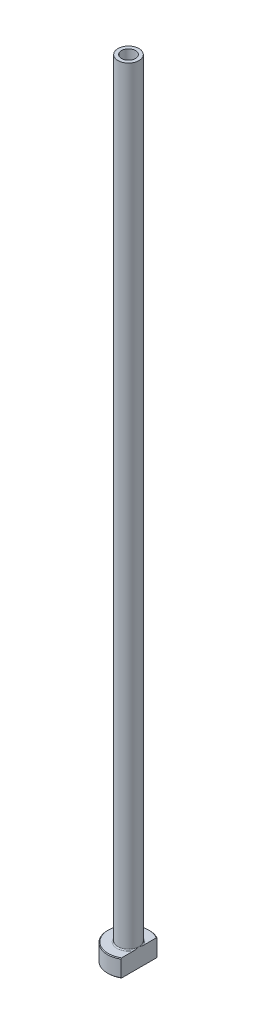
SolidWorks part; units mm, degrees
ref_plane "Front Plane" through (0, 0, 0) normal (0, 0, 1) x (1, 0, 0)
ref_plane "Top Plane" through (0, 0, 0) normal (0, 1, 0) x (1, 0, 0)
ref_plane "Right Plane" through (0, 0, 0) normal (1, 0, 0) x (0, 0, -1)
sketch "Sketch1" plane through (0, 0, 0) normal (0, 0, 1) x (1, 0, 0)
  line L0 (-2, 225) -> (-3, 225)
  line L1 (-3, 225) -> (-3, 5)
  line L2 (-3, 5) -> (-6, 5)
  line L3 (-6, 5) -> (-6, 0)
  line L4 (4.95, 0) -> (-4.95, 0) construction
  line L5 (-6, 0) -> (-2.25, 0)
  line L6 (-2, 180) -> (-2, 225)
  line L7 (0, 92.1877) -> (0, -15.5353) construction
  line L8 (0, -6.6) -> (0, 6.6) construction
  line L9 (-2, 180) -> (-2.25, 168)
  line L10 (-2.25, 168) -> (-2.25, 0)
  dimension "D1" = 0.25
  dimension "ID" = 4
  dimension "OD" = 6
  dimension "L" = 225
  dimension "H" = 12
  dimension "T" = 5
  dimension "N" = 45
  dimension "D2" = 12
  dimension "L-N" = 180
revolve "Revolve1" add sketch "Sketch1" angle 360 about L7
fillet "Fillet1" radius 0.3 1 edges at (0, 5, 3)
chamfer "Chamfer1" distance 0.2 angle 45 2 edges at (0, 5, 6) (0, 0, 6)
sketch "Sketch2" plane through (0, 0, 0) normal (0, -1, 0) x (1, 0, 0)
  line L0 (3, 5.1962) -> (3, -5.1962)
  circle A0 centre (0, 0) radius 6 construction
  arc A1 (3, 5.1962) -> (3, -5.1962) centre (0, 0) cw
  circle A2 centre (0, 0) radius 3 construction
extrude "Cut-Extrude1" cut sketch "Sketch2" against normal through all
chamfer "Chamfer2" distance 0.5 angle 45 1 edges at (0, 0, 2.25)
